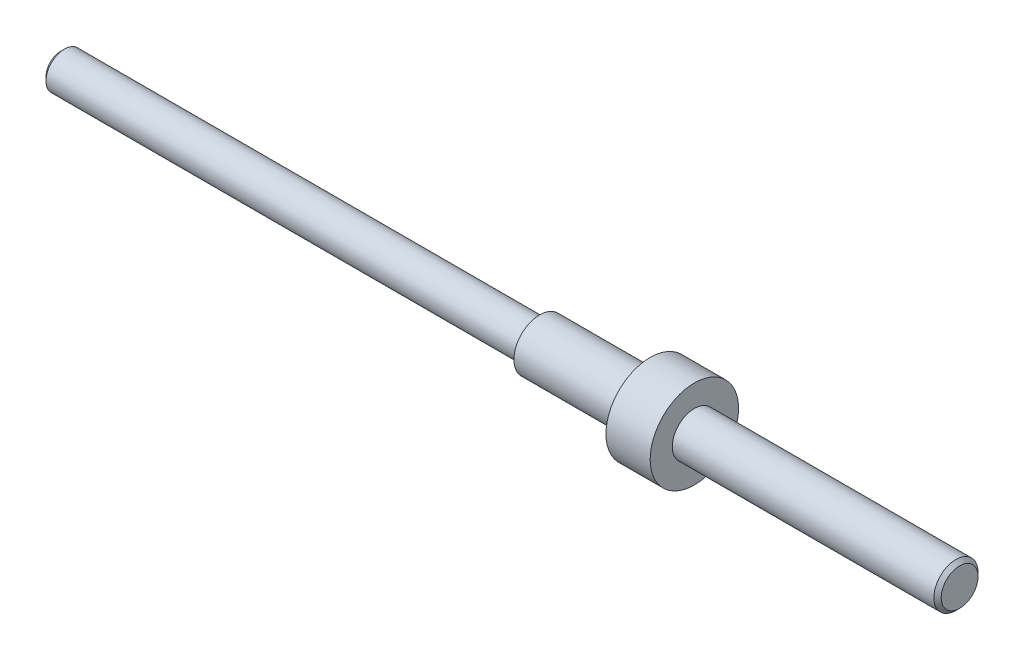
SolidWorks part; units mm, degrees
ref_plane "Plan de face" through (0, 0, 0) normal (0, 0, 1) x (1, 0, 0)
ref_plane "Plan de dessus" through (0, 0, 0) normal (0, 1, 0) x (1, 0, 0)
ref_plane "Plan de droite" through (0, 0, 0) normal (1, 0, 0) x (0, 0, -1)
sketch "Esquisse1" plane through (0, 0, 0) normal (0, 0, 1) x (1, 0, 0)
  line L0 (0, 0) -> (0, 3)
  line L1 (0, 3) -> (-36, 3)
  line L2 (-36, 3) -> (-36, 6)
  line L3 (-36, 6) -> (-42, 6)
  line L4 (-42, 6) -> (-42, 3.5)
  line L5 (-42, 3.5) -> (-57, 3.5)
  line L6 (-57, 3.5) -> (-57, 2.5)
  line L7 (-57, 2.5) -> (-122, 2.5)
  line L8 (-122, 2.5) -> (-122, 0)
  line L11 (-122, 0) -> (0, 0)
  dimension "D1" = 36
  dimension "D2" = 6
  dimension "D3" = 15
  dimension "D4" = 65
  dimension "D6" = 3
  dimension "D7" = 6
  dimension "D8" = 3.5
  dimension "D9" = 2.5
revolve "Révolution1" add sketch "Esquisse1" angle 360 about L11
chamfer "Chanfrein1" distance 0.5 angle 45 2 edges at (-122, 0, 2.5) (0, 0, 3)
